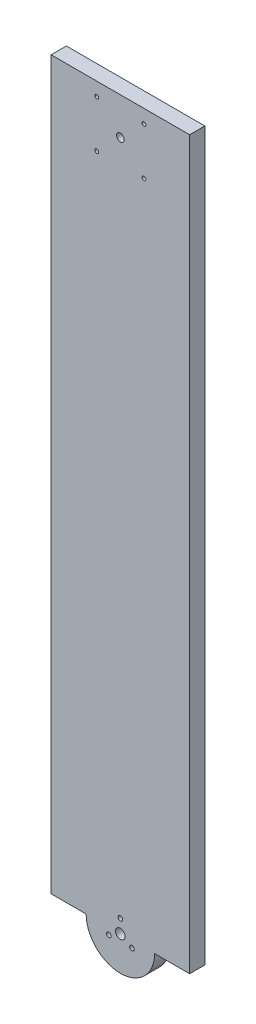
SolidWorks part; units mm, degrees
ref_plane "Front Plane" through (0, 0, 0) normal (0, 0, 1) x (1, 0, 0)
ref_plane "Top Plane" through (0, 0, 0) normal (0, 1, 0) x (1, 0, 0)
ref_plane "Right Plane" through (0, 0, 0) normal (1, 0, 0) x (0, 0, -1)
sketch "Sketch1" plane through (0, 0, 0) normal (0, 0, 1) x (1, 0, 0)
  line L0 (0, -1565.9861) -> (0, 76733.3209) construction
  line L1 (-22.5, 130) -> (22.5, 130)
  line L2 (-22.5, 130) -> (-22.5, -347.5)
  line L4 (22.5, 130) -> (22.5, -347.5)
  line L5 (-22.5, 130) -> (29.4093, -169.9204) construction
  line L6 (-22.5, -130) -> (22.5, 130) construction
  line L7 (-1565.9861, 0) -> (76733.3209, 0) construction
  line L8 (-42.7696, 105.6639) -> (42.7696, 105.6639) construction
  line L9 (-21.1, 126.7639) -> (21.1, 126.7639) construction
  line L10 (-21.1, 126.7639) -> (-21.1, 84.5639) construction
  line L11 (-21.1, 84.5639) -> (21.1, 84.5639) construction
  line L12 (21.1, 126.7639) -> (21.1, 84.5639) construction
  line L13 (-21.1, 126.7639) -> (21.1, 84.5639) construction
  line L14 (-21.1, 84.5639) -> (21.1, 126.7639) construction
  circle A0 centre (-15.5, 121.1639) radius 1.25
  circle A1 centre (15.5, 121.1639) radius 1.25
  circle A2 centre (15.5, 90.1639) radius 1.25
  circle A3 centre (-15.5, 90.1639) radius 1.25
  circle A4 centre (0, 105.6639) radius 2.5
  circle A5 centre (0, -347.5) radius 8.75 construction
  arc A6 (-22.5, -347.5) -> (22.5, -347.5) centre (0, -347.5) ccw
  circle A7 centre (0, -338.75) radius 1.5
  circle A8 centre (7.5777, -351.875) radius 1.5
  circle A9 centre (-7.5777, -351.875) radius 1.5
  circle A10 centre (0, -347.5) radius 3.15
  point P0 (0, 0)
  point P9 (0, 105.6639)
  point P20 (0, 105.6639)
  point P28 (0, 83.0234)
  point P40 (0, -370)
  point P43 (0, -247.5)
  point P45 (0, -347.5)
  point P46 (0, -107.5)
  point P49 (0, -147.5)
  dimension "D4" = 2.5
  dimension "D6" = 5
  dimension "D9" = 17.5
  dimension "D10" = 3
  dimension "D12" = 6.3
  dimension "D1" = 45
  dimension "D2" = 500
  dimension "D3" = 42.2
  dimension "D5" = 31
  dimension "D7" = 3
extrude "Boss-Extrude1" add sketch "Sketch1" along normal blind 10
sketch "Sketch2" plane through (22.5, 0, 0) normal (1, 0, 0) x (0, 0, -1)
  line L1 (-10, 130) -> (0, 130)
  line L2 (-10, 130) -> (-10, -347.5)
  line L3 (-10, -347.5) -> (0, -347.5)
  line L4 (0, 130) -> (0, -347.5)
extrude "Boss-Extrude2" add sketch "Sketch2" along normal blind 23
sketch "Sketch3" plane through (-22.5, 0, 0) normal (-1, 0, 0) x (0, 0, 1)
  line L1 (0, 130) -> (10, 130)
  line L2 (0, 130) -> (0, -347.5)
  line L3 (0, -347.5) -> (10, -347.5)
  line L4 (10, 130) -> (10, -347.5)
extrude "Boss-Extrude3" add sketch "Sketch3" along normal blind 23
